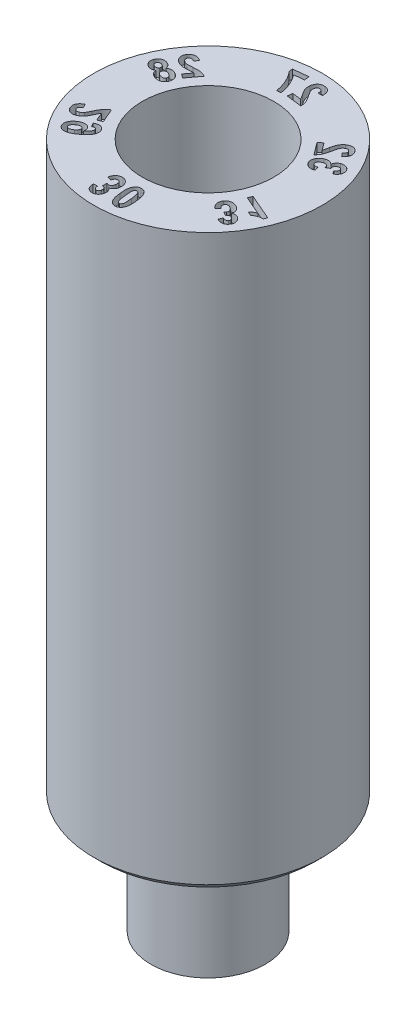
SolidWorks part; units mm, degrees
other "<M4L10-SetScrew>-<Chamfer1>" parameters "D10"=0.24
ref_plane "Front Plane" through (0, 0, 0) normal (0, 0, 1) x (1, 0, 0)
ref_plane "Top Plane" through (0, 0, 0) normal (0, 1, 0) x (1, 0, 0)
ref_plane "Right Plane" through (0, 0, 0) normal (1, 0, 0) x (0, 0, -1)
sketch "Sketch1" plane through (0, 0, 0) normal (0, 0, 1) x (1, 0, 0)
  line L0 (0, 0) -> (0, 20) construction
  line L1 (0, -4.4) -> (0, 4.4) construction
  line L2 (2, -20) -> (3.76, -20)
  line L4 (4, -19.76) -> (4, 0)
  line L5 (4, 0) -> (2.3, 0)
  line L6 (2.3, 0) -> (2.3, -4)
  line L7 (2.3, -4) -> (1.25, -4)
  line L8 (1.25, -4) -> (1.25, -14)
  line L9 (1.25, -14) -> (2, -14)
  line L10 (2, -14) -> (2, -20)
  line L11 (3.76, -20) -> (4, -19.76)
  point P6 (4, -20)
  dimension "D1" = 4
  dimension "D2" = 6
  dimension "D3" = 2.5
  dimension "D4" = 4.6
  dimension "D5" = 8
  dimension "D6" = 4
  dimension "D7" = 20
revolve "Revolve1" add sketch "Sketch1" angle 360 about L0
sketch "Sketch2" plane through (0, 0, 0) normal (0, 1, 0) x (1, 0, 0)
  line L0 (0, 0) -> (0, 4.1718) construction
  line L1 (0, 0) -> (3.6129, 2.0859) construction
  line L2 (0, 0) -> (3.6129, -2.0859) construction
  line L3 (0, 0) -> (0, -4.1718) construction
  line L4 (0, 0) -> (-3.6129, -2.0859) construction
  line L5 (0, 0) -> (-3.6129, 2.0859) construction
  arc A0 (0.6386, 2.6285) -> (1.3901, 2.3205) centre (0, 0) ccw construction
  text T0 "27     28     29     30     31     32" font "Arial Narrow" height 0.98
  point P12 (0, 0)
  point P16 (0, 0)
  point P17 (0, 0)
  point P20 (0, 0)
  dimension "D1" = 5.41
  dimension "D2" = 6
extrude "Cut-Extrude1" cut sketch "Sketch2" against normal blind 0.3
inserted part "M4L10-SetScrew"
move or copy body "Body-Move/Copy2" placed by mates yes
other "Distance1" parameters "D1"=4
